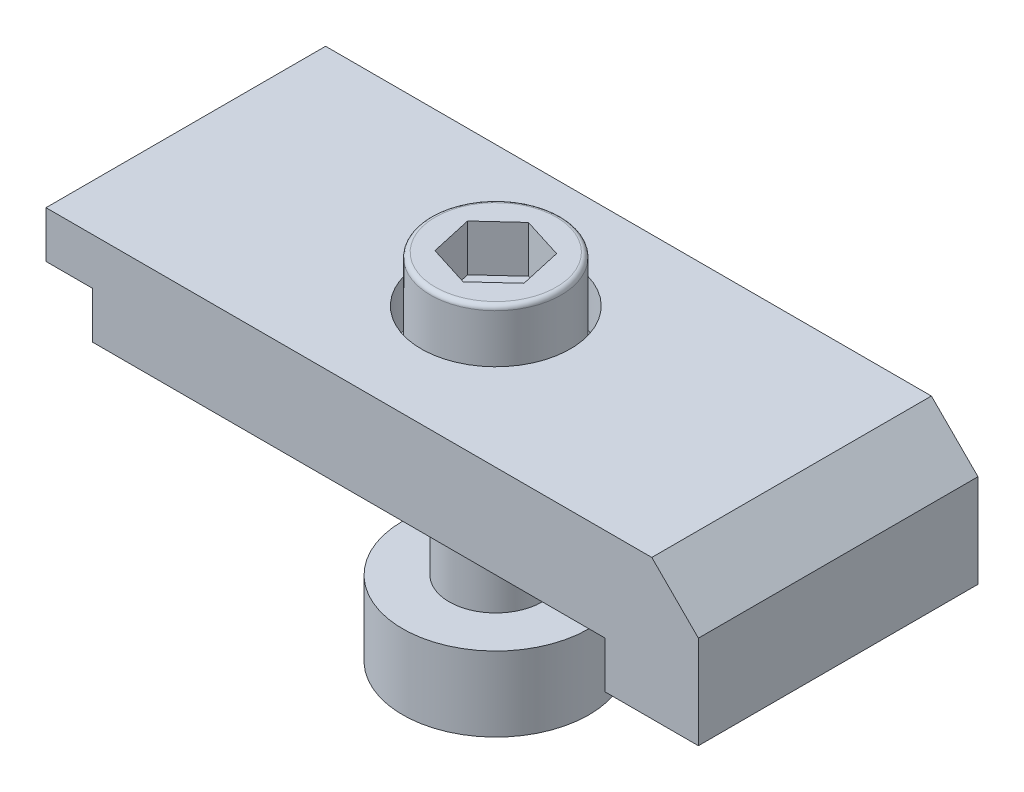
SolidWorks part; units mm, degrees
ref_plane "Face" through (0, 0, 0) normal (0, 0, 1) x (1, 0, 0)
ref_plane "Dessus" through (0, 0, 0) normal (0, 1, 0) x (1, 0, 0)
ref_plane "Droite" through (0, 0, 0) normal (1, 0, 0) x (0, 0, -1)
sketch "Esquisse1" plane through (0, 0, 0) normal (0, 0, 1) x (1, 0, 0)
  line L0 (0, 0) -> (-10, 0)
  line L1 (-10, 0) -> (-10, 5)
  line L2 (-10, 5) -> (-65, 5)
  line L3 (-65, 5) -> (-65, 10)
  line L4 (-65, 10) -> (-70, 10)
  line L5 (-70, 10) -> (-70, 15)
  line L6 (-70, 15) -> (0, 15)
  line L7 (0, 15) -> (0, 0)
  dimension "D1" = 5
  dimension "D2" = 5
  dimension "D3" = 10
  dimension "D4" = 5
  dimension "D5" = 70
  dimension "D6" = 10
extrude "Extrusion1" add sketch "Esquisse1" along normal mid plane 30
chamfer "Chanfrein1" distance 5 angle 45 1 edges at (0, 15, 0)
sketch "Esquisse2" plane through (0, 15, 0) normal (0, 1, 0) x (-1, 0, 0)
  line L0 (5, 15) -> (70, 15) construction
  circle A0 centre (36.7395, 0) radius 8
  dimension "D1" = 16
  dimension "D2" = 15
extrude "Enlèv. mat.-Extru.1" cut sketch "Esquisse2" against normal blind 5
sketch "Esquisse3" plane through (0, 10, 0) normal (0, 1, 0) x (-1, 0, 0)
  circle A0 centre (36.7395, 0) radius 7
  circle A1 centre (36.7395, 0) radius 8 construction
  dimension "D1" = 14
extrude "Extrusion2" add sketch "Esquisse3" along normal blind 10
sketch "Esquisse4" plane through (0, 20, 0) normal (0, 1, 0) x (-1, 0, 0)
  line L1 (33.3392, -3.126) -> (37.7465, -4.5077)
  line L2 (37.7465, -4.5077) -> (41.1468, -1.3817)
  line L3 (41.1468, -1.3817) -> (40.1397, 3.126)
  line L4 (40.1397, 3.126) -> (35.7324, 4.5077)
  line L5 (35.7324, 4.5077) -> (32.3322, 1.3817)
  line L6 (32.3322, 1.3817) -> (33.3392, -3.126)
  circle A0 centre (36.7395, 0) radius 4 construction
  circle A1 centre (36.7395, 0) radius 7 construction
  dimension "D1" = 8
extrude "Enlèv. mat.-Extru.2" cut sketch "Esquisse4" against normal blind 6
fillet "Congé1" radius 0.5 1 edges at (-43.7395, 20, 0)
sketch "Esquisse5" plane through (0, 15, 0) normal (0, 1, 0) x (-1, 0, 0)
  circle A0 centre (36.7395, 0) radius 5
  circle A1 centre (36.7395, 0) radius 8 construction
  dimension "D1" = 10
extrude "Extrusion3" add sketch "Esquisse5" against normal blind 33
sketch "Esquisse6" plane through (0, -18, 0) normal (0, -1, 0) x (1, 0, 0)
  circle A0 centre (-36.7395, 0) radius 10
  circle A1 centre (-36.7395, 0) radius 5 construction
  dimension "D1" = 20
extrude "Extrusion4" add sketch "Esquisse6" against normal blind 8
